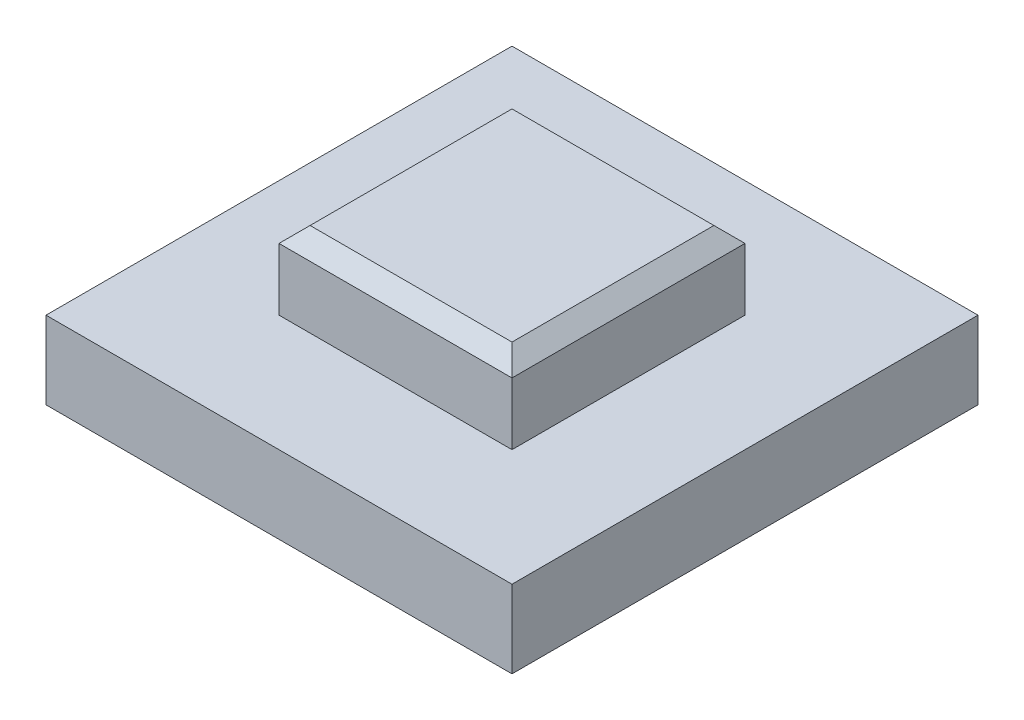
SolidWorks part; units mm, degrees
ref_plane "Front Plane" through (0, 0, 0) normal (0, 0, 1) x (1, 0, 0)
ref_plane "Top Plane" through (0, 0, 0) normal (0, 1, 0) x (1, 0, 0)
ref_plane "Right Plane" through (0, 0, 0) normal (1, 0, 0) x (0, 0, -1)
sketch "Sketch1" plane through (0, 0, 0) normal (0, 1, 0) x (1, 0, 0)
  line L0 (-38.1, -38.1) -> (38.1, 38.1) construction
  line L1 (-38.1, 38.1) -> (38.1, 38.1)
  line L2 (-38.1, 38.1) -> (-38.1, -38.1)
  line L3 (-38.1, -38.1) -> (38.1, -38.1)
  line L4 (38.1, 38.1) -> (38.1, -38.1)
  dimension "D1" = 76.2
  dimension "D2" = 76.2
extrude "Extrude1" add sketch "Sketch1" along normal blind 12.7
sketch "Sketch2" plane through (0, 12.7, 0) normal (0, 1, 0) x (-1, 0, 0)
  line L0 (19.05, -19.05) -> (-19.05, 19.05) construction
  line L1 (-19.05, -19.05) -> (19.05, -19.05)
  line L2 (-19.05, -19.05) -> (-19.05, 19.05)
  line L3 (-19.05, 19.05) -> (19.05, 19.05)
  line L4 (19.05, -19.05) -> (19.05, 19.05)
  dimension "D1" = 38.1
  dimension "D2" = 38.1
extrude "Extrude2" add sketch "Sketch2" along normal blind 12.7
chamfer "Chamfer1" distance 2.54 angle 45 4 edges at (19.05, 25.4, 0) (0, 25.4, -19.05) (-19.05, 25.4, 0) (0, 25.4, 19.05)
